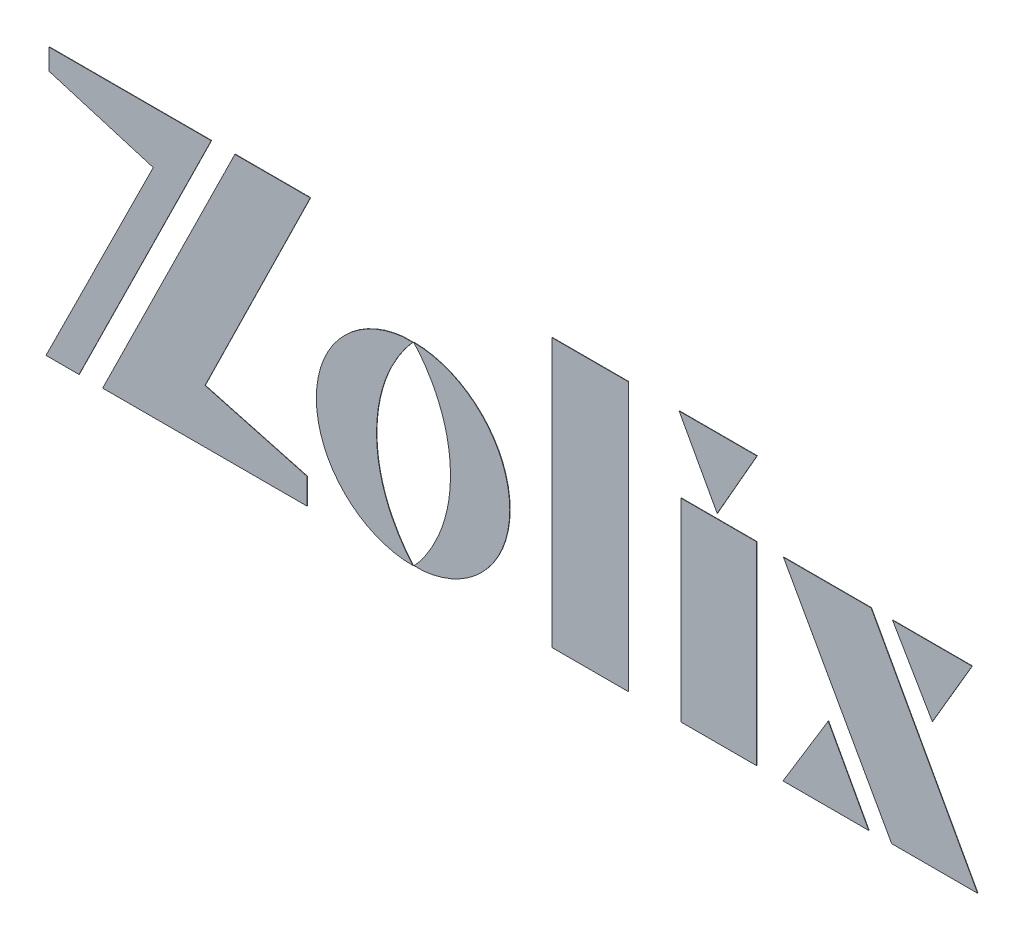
SolidWorks part; units mm, degrees
ref_plane "前视基准面" through (0, 0, 0) normal (0, 0, 1) x (1, 0, 0)
ref_plane "上视基准面" through (0, 0, 0) normal (0, 1, 0) x (1, 0, 0)
ref_plane "右视基准面" through (0, 0, 0) normal (1, 0, 0) x (0, 0, -1)
sketch "草图1" plane through (0, 0, 0) normal (0, 0, 1) x (1, 0, 0)
  line L0 (40.9383, -7.113) -> (31.1928, -7.113)
  line L1 (31.1928, -7.113) -> (31.1928, 27.2434)
  line L2 (31.1928, 27.2434) -> (40.9383, 27.2434)
  line L3 (40.9383, 27.2434) -> (40.9383, -7.113)
  line L4 (60.7961, 17.711) -> (72.0186, 17.711)
  line L5 (72.0186, 17.711) -> (85.6486, -7.113)
  line L6 (85.6486, -7.113) -> (74.6438, -7.113)
  line L7 (74.6438, -7.113) -> (60.7961, 17.711)
  line L8 (74.7645, 17.711) -> (84.9384, 17.711)
  line L9 (84.9384, 17.711) -> (79.8538, 9.0142)
  line L10 (79.8538, 9.0142) -> (74.7645, 17.711)
  line L11 (66.5293, 2.417) -> (60.7345, -7.113)
  line L12 (60.7345, -7.113) -> (71.7133, -7.113)
  line L13 (71.7133, -7.113) -> (66.5293, 2.417)
  line L14 (8.7122, 5.4682) -> (8.7643, 6.8932)
  line L15 (8.7643, 6.8932) -> (8.9134, 8.2401)
  line L16 (8.9134, 8.2401) -> (9.1454, 9.5065)
  line L17 (9.1454, 9.5065) -> (9.4437, 10.6925)
  line L18 (9.4437, 10.6925) -> (9.7987, 11.7956)
  line L19 (9.7987, 11.7956) -> (10.1964, 12.811)
  line L20 (10.1964, 12.811) -> (10.6201, 13.7413)
  line L21 (10.6201, 13.7413) -> (11.4983, 15.332)
  line L22 (11.4983, 15.332) -> (12.3221, 16.5487)
  line L23 (12.3221, 16.5487) -> (12.9825, 17.3796)
  line L24 (12.9825, 17.3796) -> (13.3707, 17.8081)
  line L25 (13.3707, 17.8081) -> (12.1304, 17.8009)
  line L26 (12.1304, 17.8009) -> (10.8995, 17.6139)
  line L27 (10.8995, 17.6139) -> (9.7135, 17.3086)
  line L28 (9.7135, 17.3086) -> (8.5749, 16.892)
  line L29 (8.5749, 16.892) -> (7.4908, 16.3688)
  line L30 (7.4908, 16.3688) -> (6.4682, 15.7486)
  line L31 (6.4682, 15.7486) -> (5.5142, 15.0338)
  line L32 (5.5142, 15.0338) -> (4.6337, 14.2337)
  line L33 (4.6337, 14.2337) -> (3.8336, 13.3531)
  line L34 (3.8336, 13.3531) -> (3.1211, 12.3992)
  line L35 (3.1211, 12.3992) -> (2.4985, 11.3766)
  line L36 (2.4985, 11.3766) -> (1.9777, 10.2924)
  line L37 (1.9777, 10.2924) -> (1.5611, 9.1538)
  line L38 (1.5611, 9.1538) -> (1.2558, 7.9655)
  line L39 (1.2558, 7.9655) -> (1.0664, 6.7346)
  line L40 (1.0664, 6.7346) -> (1.0025, 5.4682)
  line L41 (1.0025, 5.4682) -> (1.0664, 4.2018)
  line L42 (1.0664, 4.2018) -> (1.2558, 2.9709)
  line L43 (1.2558, 2.9709) -> (1.5611, 1.7826)
  line L44 (1.5611, 1.7826) -> (1.9777, 0.644)
  line L45 (1.9777, 0.644) -> (2.4985, -0.4401)
  line L46 (2.4985, -0.4401) -> (3.1211, -1.4627)
  line L47 (3.1211, -1.4627) -> (3.8336, -2.4167)
  line L48 (3.8336, -2.4167) -> (4.6337, -3.2973)
  line L49 (4.6337, -3.2973) -> (5.5142, -4.0973)
  line L50 (5.5142, -4.0973) -> (6.4682, -4.8122)
  line L51 (6.4682, -4.8122) -> (7.4908, -5.4324)
  line L52 (7.4908, -5.4324) -> (8.5749, -5.9555)
  line L53 (8.5749, -5.9555) -> (9.7135, -6.3721)
  line L54 (9.7135, -6.3721) -> (10.8995, -6.6775)
  line L55 (10.8995, -6.6775) -> (12.1304, -6.8645)
  line L56 (12.1304, -6.8645) -> (13.3991, -6.9284)
  line L57 (13.3991, -6.9284) -> (13.2263, -6.7059)
  line L58 (13.2263, -6.7059) -> (12.3339, -5.6028)
  line L59 (12.3339, -5.6028) -> (11.5102, -4.3814)
  line L60 (11.5102, -4.3814) -> (10.6296, -2.7907)
  line L61 (10.6296, -2.7907) -> (10.2035, -1.8604)
  line L62 (10.2035, -1.8604) -> (9.8058, -0.8425)
  line L63 (9.8058, -0.8425) -> (9.4484, 0.2582)
  line L64 (9.4484, 0.2582) -> (9.1478, 1.4417)
  line L65 (9.1478, 1.4417) -> (8.9134, 2.7058)
  line L66 (8.9134, 2.7058) -> (8.7643, 4.0479)
  line L67 (8.7643, 4.0479) -> (8.7122, 5.4682)
  line L68 (13.463, 17.8649) -> (14.2111, 17.0151)
  line L69 (14.2111, 17.0151) -> (14.9662, 15.9877)
  line L70 (14.9662, 15.9877) -> (15.8302, 14.5817)
  line L71 (15.8302, 14.5817) -> (16.2681, 13.7413)
  line L72 (16.2681, 13.7413) -> (16.6918, 12.811)
  line L73 (16.6918, 12.811) -> (17.0895, 11.7956)
  line L74 (17.0895, 11.7956) -> (17.4445, 10.6925)
  line L75 (17.4445, 10.6925) -> (17.7452, 9.5065)
  line L76 (17.7452, 9.5065) -> (17.9748, 8.2401)
  line L77 (17.9748, 8.2401) -> (18.1239, 6.8932)
  line L78 (18.1239, 6.8932) -> (18.176, 5.4682)
  line L79 (18.176, 5.4682) -> (18.1239, 4.0479)
  line L80 (18.1239, 4.0479) -> (17.9748, 2.7058)
  line L81 (17.9748, 2.7058) -> (17.7428, 1.4417)
  line L82 (17.7428, 1.4417) -> (17.4398, 0.2582)
  line L83 (17.4398, 0.2582) -> (17.0847, -0.8425)
  line L84 (17.0847, -0.8425) -> (16.6847, -1.8604)
  line L85 (16.6847, -1.8604) -> (15.8207, -3.631)
  line L86 (15.8207, -3.631) -> (14.9543, -5.0394)
  line L87 (14.9543, -5.0394) -> (14.1992, -6.0715)
  line L88 (14.1992, -6.0715) -> (13.5151, -6.8692)
  line L89 (13.5151, -6.8692) -> (14.7247, -6.8598)
  line L90 (14.7247, -6.8598) -> (15.9462, -6.668)
  line L91 (15.9462, -6.668) -> (17.1274, -6.3603)
  line L92 (17.1274, -6.3603) -> (18.2588, -5.9413)
  line L93 (18.2588, -5.9413) -> (19.3335, -5.4182)
  line L94 (19.3335, -5.4182) -> (20.349, -4.798)
  line L95 (20.349, -4.798) -> (21.2959, -4.0831)
  line L96 (21.2959, -4.0831) -> (22.167, -3.2854)
  line L97 (22.167, -3.2854) -> (22.96, -2.4072)
  line L98 (22.96, -2.4072) -> (23.6677, -1.4533)
  line L99 (23.6677, -1.4533) -> (24.2832, -0.433)
  line L100 (24.2832, -0.433) -> (24.7992, 0.6488)
  line L101 (24.7992, 0.6488) -> (25.2135, 1.785)
  line L102 (25.2135, 1.785) -> (25.5141, 2.9709)
  line L103 (25.5141, 2.9709) -> (25.7011, 4.2018)
  line L104 (25.7011, 4.2018) -> (25.765, 5.4682)
  line L105 (25.765, 5.4682) -> (25.7011, 6.7299)
  line L106 (25.7011, 6.7299) -> (25.5141, 7.9561)
  line L107 (25.5141, 7.9561) -> (25.2135, 9.1373)
  line L108 (25.2135, 9.1373) -> (24.7992, 10.2711)
  line L109 (24.7992, 10.2711) -> (24.2832, 11.3505)
  line L110 (24.2832, 11.3505) -> (23.6677, 12.3708)
  line L111 (23.6677, 12.3708) -> (22.96, 13.3223)
  line L112 (22.96, 13.3223) -> (22.167, 14.2006)
  line L113 (22.167, 14.2006) -> (21.2959, 14.9983)
  line L114 (21.2959, 14.9983) -> (20.349, 15.7131)
  line L115 (20.349, 15.7131) -> (19.3335, 16.3357)
  line L116 (19.3335, 16.3357) -> (18.2588, 16.8612)
  line L117 (18.2588, 16.8612) -> (17.1274, 17.2825)
  line L118 (17.1274, 17.2825) -> (15.9462, 17.595)
  line L119 (15.9462, 17.595) -> (14.7247, 17.7915)
  line L120 (14.7247, 17.7915) -> (13.463, 17.8649)
  line L121 (0.2308, 27.2695) -> (-9.42, 27.2695)
  line L122 (-9.42, 27.2695) -> (-26.3497, -7.113)
  line L123 (-26.3497, -7.113) -> (-0.1692, -7.113)
  line L124 (-0.1692, -7.113) -> (-0.1692, -3.8133)
  line L125 (-0.1692, -3.8133) -> (-13.2476, -0.2673)
  line L126 (-13.2476, -0.2673) -> (0.2308, 27.2695)
  line L127 (-12.4452, 27.2695) -> (-29.3725, -7.113)
  line L128 (-29.3725, -7.113) -> (-33.6002, -7.113)
  line L129 (-33.6002, -7.113) -> (-19.8732, 20.58)
  line L130 (-19.8732, 20.58) -> (-33.2262, 24.5899)
  line L131 (-33.2262, 24.5899) -> (-33.2262, 27.2695)
  line L132 (-33.2262, 27.2695) -> (-12.4452, 27.2695)
  line L133 (57.3709, -7.113) -> (47.6585, -7.113)
  line L134 (47.6585, -7.113) -> (47.6585, 17.711)
  line L135 (47.6585, 17.711) -> (57.3709, 17.711)
  line L136 (57.3709, 17.711) -> (57.3709, -7.113)
  line L137 (47.4431, 27.2434) -> (52.3147, 18.3265)
  line L138 (52.3147, 18.3265) -> (57.404, 27.2434)
  line L139 (57.404, 27.2434) -> (47.4431, 27.2434)
extrude "凸台-拉伸1" add sketch "草图1" along normal blind 0.05
